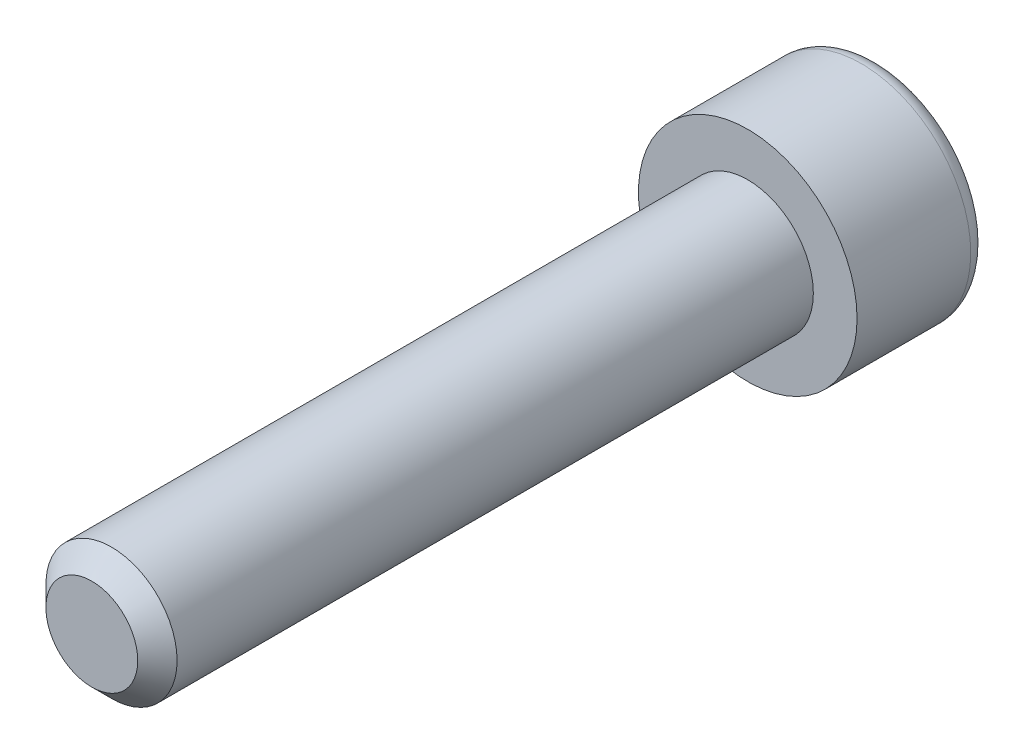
SolidWorks part; units mm, degrees
ref_plane "Plan1" through (0, 0, 0) normal (0, 0, 1) x (1, 0, 0)
ref_plane "Plan2" through (0, 0, 0) normal (0, 1, 0) x (1, 0, 0)
ref_plane "Plan3" through (0, 0, 0) normal (1, 0, 0) x (0, 0, -1)
sketch "Esquisse1" plane through (0, 0, 0) normal (0, 0, 1) x (1, 0, 0)
  circle A0 centre (0, 0) radius 3
extrude "Corps" add sketch "Esquisse1" along normal blind 30
chamfer "Chanfrein2" distance 0.9 angle 45 1 edges at (3, 0, 30)
extrude "Tete" add sketch "Esquisse2" against normal blind 6
sketch "Esquisse2" plane through (0, 0, 0) normal (0, 0, 1) x (1, 0, 0)
  circle A0 centre (0, 0) radius 5
ref_plane "Plan4" through (0, 0, -6) normal (0, 0, 1) x (1, 0, 0)
sketch "Esquisse3" plane through (0, 0, -6) normal (0, 0, 1) x (1, 0, 0)
  line L1 (0, -2.8868) -> (2.5, -1.4434)
  line L2 (2.5, -1.4434) -> (2.5, 1.4434)
  line L3 (2.5, 1.4434) -> (0, 2.8868)
  line L4 (0, 2.8868) -> (-2.5, 1.4434)
  line L5 (-2.5, 1.4434) -> (-2.5, -1.4434)
  line L6 (-2.5, -1.4434) -> (0, -2.8868)
  circle A0 centre (0, 0) radius 2.5 construction
  dimension "D1" = 5
extrude "6pans" cut sketch "Esquisse3" along normal blind 4.2
fillet "Congé1" radius 0.8 1 edges at (5, 0, -6)
equation "\"D1@Congé1\"=\"D1@Esquisse2\"*0.08"
equation "\"D1@Chanfrein2\"=\"D@Esquisse1\"*0.15"
equation "\"HT@6pans\"=\"HT@Tete\"*0.7"
equation "\"D1@Plan4\" = \"HT@Tete\""
